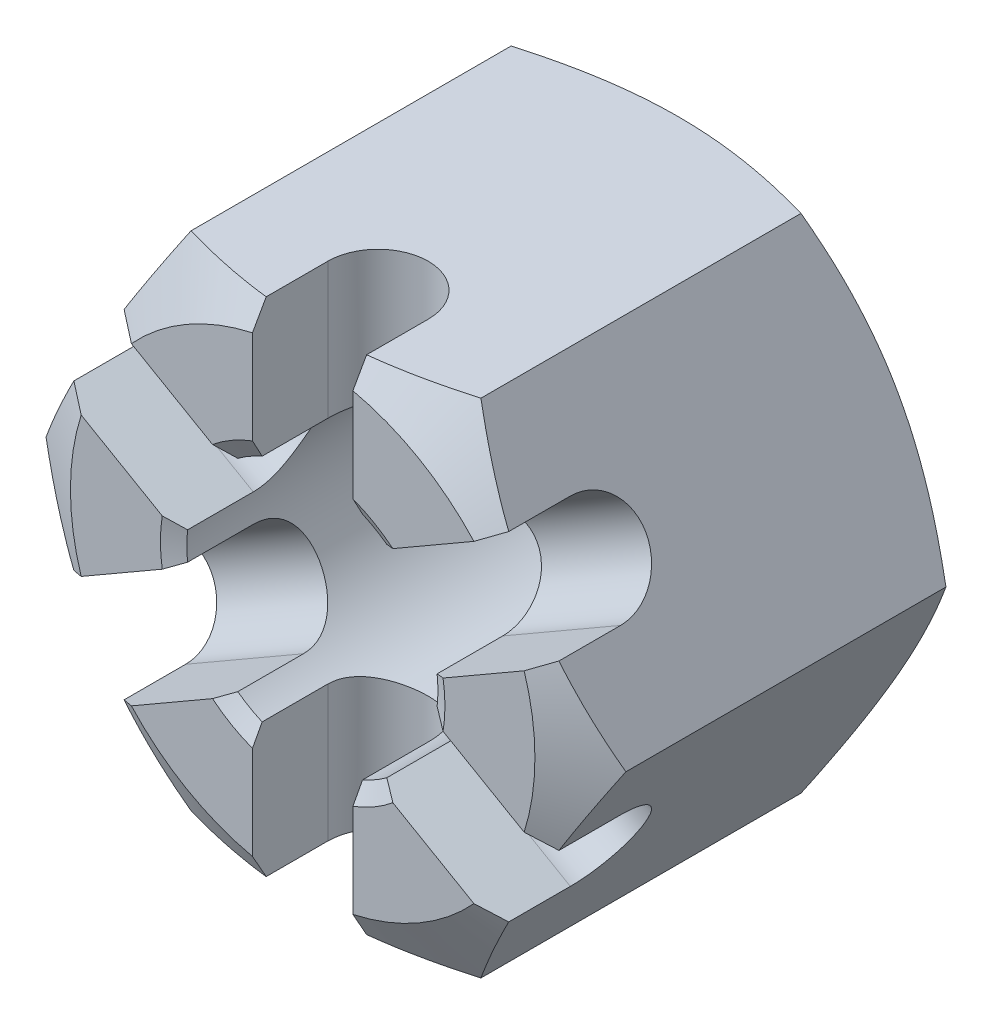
SolidWorks part; units mm, degrees
ref_plane "Front" through (0, 0, 0) normal (0, 0, 1) x (1, 0, 0)
ref_plane "Top" through (0, 0, 0) normal (0, 1, 0) x (1, 0, 0)
ref_plane "Right" through (0, 0, 0) normal (1, 0, 0) x (0, 0, -1)
sketch "Sketch1" plane through (0, 0, 0) normal (0, 0, 1) x (1, 0, 0)
  line L1 (2.8868, -5) -> (5.7735, 0)
  line L2 (5.7735, 0) -> (2.8868, 5)
  line L3 (2.8868, 5) -> (-2.8868, 5)
  line L4 (-2.8868, 5) -> (-5.7735, 0)
  line L5 (-5.7735, 0) -> (-2.8868, -5)
  line L6 (-2.8868, -5) -> (2.8868, -5)
  circle A0 centre (0, 0) radius 5 construction
  circle A1 centre (0, 0) radius 2.5
  dimension "D" = 5
  dimension "s" = 10
extrude "BaseNut" add sketch "Sketch1" against normal blind 7.7
sketch "Sketch2" plane through (0, 0, 0) normal (0, 1, 0) x (1, 0, 0)
  line L0 (-5.7735, 7.7) -> (-4.625, 7.7)
  line L2 (-4.625, 7.7) -> (-5.7735, 7.0369)
  line L3 (-5.7735, 7.0369) -> (-5.7735, 7.7)
  line L4 (0, 3.3759) -> (0, -9.8171) construction
  line L6 (-9.7712, 3.85) -> (9.8853, 3.85) construction
  line L7 (-5.7735, 0.6631) -> (-5.7735, 0)
  line L8 (-4.625, 0) -> (-5.7735, 0.6631)
  line L9 (-5.7735, 0) -> (-4.625, 0)
  dimension "D1" = 30
  dimension "dw" = 9.25
  dimension "D2" = 3.85
revolve "Double-Chamfer" cut sketch "Sketch2" angle 360 about L4
chamfer "EndChamfer" distance 0.3333 angle 30 2 edges at (2.5, 0, -7.7) (2.5, 0, 0)
sketch "Sketch3" plane through (0, 0, 0) normal (0, 1, 0) x (1, 0, 0)
  line L0 (0, 4.2201) -> (0, -10.5237) construction
  line L2 (-1, 0) -> (-1, 1.5)
  line L3 (1, 0) -> (1, 1.5)
  line L4 (2.6925, 7.7) -> (-2.6925, 7.7) construction
  arc A0 (-1, 1.5) -> (1, 1.5) centre (0, 1.5) cw
  point P2 (0, 2.5)
  point P3 (0, 7.7)
  dimension "W" = 5.2
  dimension "n" = 2
extrude "Slot" cut sketch "Sketch3" against normal through all and the other way through all
ref_axis "Axis1" through (0, 0, 9.8171) along (0, 0, -1)
pattern_circular "SlotPattern" count 3 over 360 about axis through (0, 0, 9.8171) along (0, 0, -1) of "Slot"
sketch "Sketch4" plane through (0, 0, 0) normal (0, 1, 0) x (1, 0, 0)
  line L0 (0, 9.27) -> (0, 5.1988) construction
  line L1 (2, 7.6167) -> (2.5, 7.6167)
  line L2 (2.5, 7.6167) -> (2.933, 7.3667)
  line L3 (2.933, 7.3667) -> (2.5, 7.1167)
  line L4 (2.5, 7.1167) -> (2, 7.1167)
  line L5 (2, 7.1167) -> (2, 7.6167)
  line L7 (2.5, 7.3667) -> (-2.5, 7.3667) construction
  dimension "D1" = 0.5
  dimension "D2" = 5
revolve "Cut-Revolve10" [suppressed] cut sketch "Sketch4" angle 360 about L0
pattern_linear "LPattern10" [suppressed] count 13 spacing 0.6 along (0, 0, 1)
equation "\"dw@Sketch2\" = \"s@Sketch1\"-0.75"
equation "\"D2@Sketch2\" = \"m@BaseNut\" / 2"
equation "\"D1@EndChamfer\" = \"D@Sketch1\" / 15"
equation "\"D2@Sketch4\" = \"D@Sketch1\""
equation "\"D1@Sketch4\" = (  \"D@ThreadCosmetic1\" - \"D@Sketch1\" )  / 2"
equation "\"D3@LPattern10\" = \"D1@Sketch4\" * 1.2"
equation "\"D1@LPattern10\" =  \"m@BaseNut\"   / \"D3@LPattern10\""
